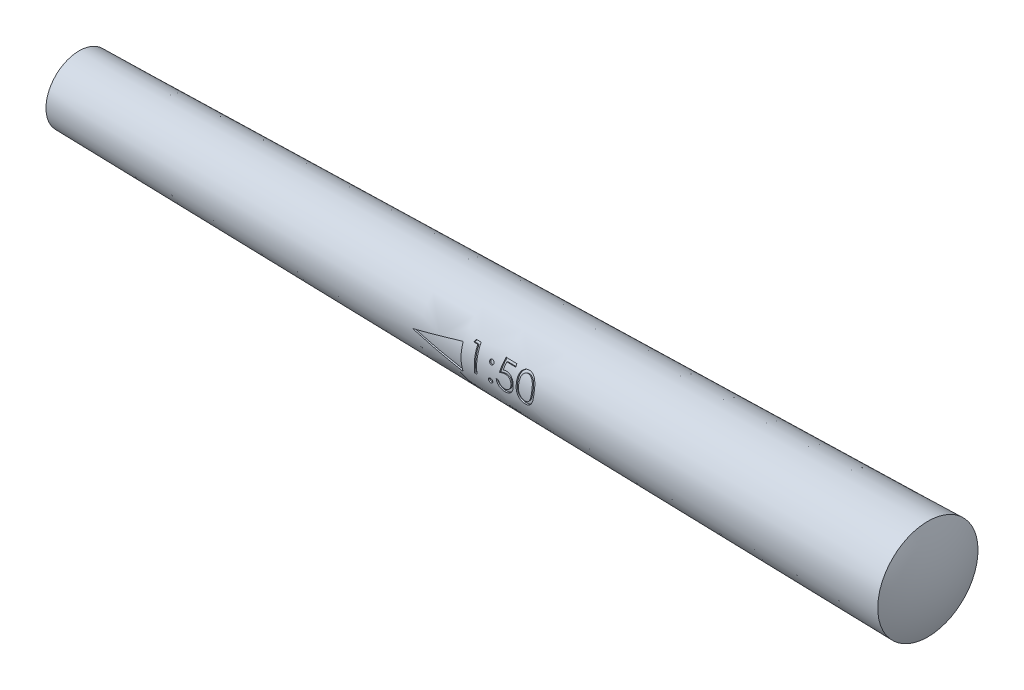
SolidWorks part; units mm, degrees
ref_plane "Front Plane" through (0, 0, 0) normal (0, 0, 1) x (1, 0, 0)
ref_plane "Top Plane" through (0, 0, 0) normal (0, 1, 0) x (1, 0, 0)
ref_plane "Right Plane" through (0, 0, 0) normal (1, 0, 0) x (0, 0, -1)
sketch "Sketch1" plane through (0, 0, 0) normal (1, 0, 0) x (0, 0, -1)
  circle A0 centre (0, 0) radius 1.25
  dimension "D1" = 2.5
extrude "Extrude1" add sketch "Sketch1" along normal mid plane 32
draft "Draft1" type of draft neutral plane draft angle 1.146 faces to draft 1 parameters "D1"=1.146
sketch "Sketch2" plane through (0, 0, 0) normal (0, 0, 1) x (1, 0, 0)
  line L0 (-16, 0) -> (-16, 1.25)
  line L1 (-16, 1.25) -> (-16, -1.25) construction
  line L2 (-16, 0) -> (-16.4, 0)
  line L3 (-16.4, 0) -> (-16.4, -1.57) construction
  line L4 (16, 0) -> (16, 1.89)
  line L5 (16, -1.89) -> (16, 1.89) construction
  line L6 (16, 0) -> (16.4, 0)
  line L7 (16.4, 0) -> (16.4, -1.57) construction
  line L8 (-16, -1.25) -> (16, -1.89) construction
  arc A0 (-16.4, 0) -> (-16, 1.25) centre (-14.2469, 0) cw
  arc A1 (16.4, 0) -> (16, 1.89) centre (11.7348, 0) ccw
  point P14 (0, -1.57)
revolve "Revolve1" add sketch "Sketch2" angle 360 about L2
sketch "Sketch5" plane through (0, 0, 0) normal (0, 0, 1) x (1, 0, 0)
  line L0 (0, 1.57) -> (0, -1.57) construction
  line L1 (16, 1.89) -> (-16, 1.25) construction
  line L2 (-16, -1.25) -> (16, -1.89) construction
ref_plane "Plane2" through (0, 0, 0) normal (-0.02, 0, 0.9998) x (0.9998, 0, 0.02)
sketch "Sketch6" plane through (0, 0, 0) normal (-0.02, 0, 0.9998) x (0.9998, 0, 0.02)
  line L0 (0, 0) -> (0, 0.5)
  line L1 (0, 1.57) -> (0, -1.57) construction
  line L2 (0, 0.5) -> (-1.866, 0)
  line L3 (-1.866, 0) -> (0, -0.5)
  line L4 (0, -0.5) -> (0, 0)
  line L5 (0, -0.25) -> (3, -0.25) construction
  text T0 "1:50" font "Century Gothic" height 1
  dimension "D1" = 1
  dimension "D2" = 30
  dimension "D3" = 3
wrap "Wrap2" sketch "Sketch6" wrap type deboss source sketch "Sketch6" thickness 0.05 parameters "D1"=0.05
equation "\"D2@Sketch2\" = \"D1@Sketch2\""
